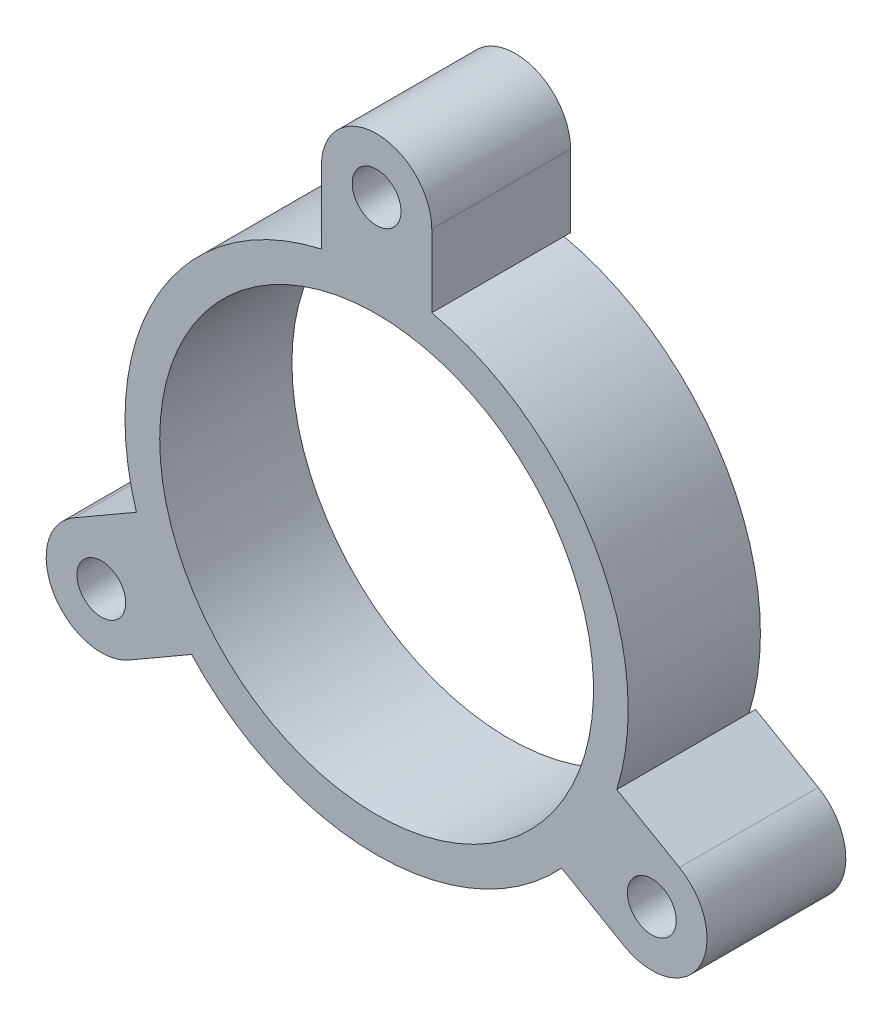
SolidWorks part; units mm, degrees
ref_plane "Front" through (0, 0, 0) normal (0, 0, 1) x (1, 0, 0)
ref_plane "Top" through (0, 0, 0) normal (0, 1, 0) x (1, 0, 0)
ref_plane "Right" through (0, 0, 0) normal (1, 0, 0) x (0, 0, -1)
sketch "Sketch1" plane through (0, 0, 0) normal (0, 0, 1) x (1, 0, 0)
  circle A0 centre (0, 0) radius 12.5
  circle A1 centre (0, 0) radius 14.5
extrude "Base-Extrude" add sketch "Sketch1" along normal blind 7.62
sketch "Sketch5" plane through (0, 0, 7.62) normal (0, 0, 1) x (1, 0, 0)
  line L0 (3.18, 14.147) -> (3.18, 18.317)
  line L1 (-3.18, 14.147) -> (-3.18, 18.317)
  line L2 (0, 0) -> (0, 32.9892) construction
  line L3 (0, 0) -> (27.8987, 16.1073) construction
  line L4 (13.8417, -4.3195) -> (17.453, -6.4045)
  line L5 (10.6617, -9.8275) -> (14.273, -11.9125)
  line L6 (-10.6617, -9.8275) -> (-14.273, -11.9125)
  line L7 (-13.8417, -4.3195) -> (-17.453, -6.4045)
  circle A0 centre (0, 0) radius 14.5 construction
  arc A1 (-3.18, 18.317) -> (3.18, 18.317) centre (0, 18.317) cw
  circle A2 centre (0, 18.317) radius 1.405
  arc A3 (3.18, 14.147) -> (-3.18, 14.147) centre (0, 0) ccw
  arc A4 (14.273, -11.9125) -> (17.453, -6.4045) centre (15.863, -9.1585) ccw
  arc A5 (13.8417, -4.3195) -> (10.6617, -9.8275) centre (0, 0) cw
  circle A6 centre (15.863, -9.1585) radius 1.405
  arc A7 (-13.8417, -4.3195) -> (-10.6617, -9.8275) centre (0, 0) ccw
  arc A8 (-14.273, -11.9125) -> (-17.453, -6.4045) centre (-15.863, -9.1585) cw
  circle A9 centre (-15.863, -9.1585) radius 1.405
  dimension "D2" = 3.18
  dimension "D3" = 60
  dimension "D1" = 4.17
extrude "Boss-Extrude1" add sketch "Sketch5" against normal blind 8
